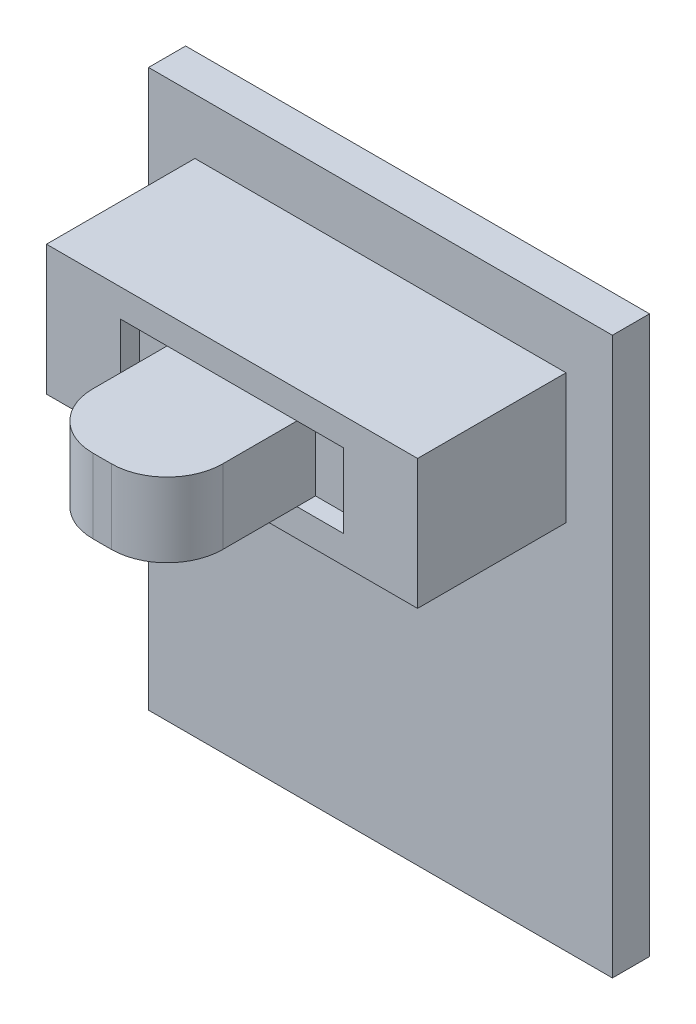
SolidWorks part; units mm, degrees
ref_plane "Plan de face" through (0, 0, 0) normal (0, 0, 1) x (1, 0, 0)
ref_plane "Plan de dessus" through (0, 0, 0) normal (0, 1, 0) x (1, 0, 0)
ref_plane "Plan de droite" through (0, 0, 0) normal (1, 0, 0) x (0, 0, -1)
sketch "Esquisse1" plane through (0, 0, 0) normal (0, 0, 1) x (1, 0, 0)
  line L1 (0, 0) -> (25, 0)
  line L2 (0, 0) -> (0, 30)
  line L3 (0, 30) -> (25, 30)
  line L4 (25, 0) -> (25, 30)
  dimension "D1" = 30
  dimension "D2" = 25
extrude "Extrusion1" add sketch "Esquisse1" along normal blind 2
sketch "Esquisse2" plane through (0, 0, 2) normal (0, 0, 1) x (1, 0, 0)
  line L0 (12.5, 30) -> (12.5, 0) construction
  line L1 (2.5, 27) -> (22.5, 27)
  line L2 (2.5, 27) -> (2.5, 20)
  line L3 (2.5, 20) -> (22.5, 20)
  line L4 (22.5, 27) -> (22.5, 20)
  line L5 (25, 30) -> (0, 30) construction
  line L6 (0, 0) -> (25, 0) construction
  line L7 (12.5, 20) -> (12.5, 50) construction
  dimension "D1" = 20
  dimension "D2" = 7
  dimension "D3" = 3
extrude "Extrusion2" add sketch "Esquisse2" along normal blind 8
sketch "Esquisse4" plane through (0, 0, 10) normal (0, 0, 1) x (1, 0, 0)
  line L0 (12.5, 27) -> (12.5, 17.3147) construction
  line L1 (6.5, 25.5) -> (18.5, 25.5)
  line L2 (6.5, 25.5) -> (6.5, 21.5)
  line L3 (6.5, 21.5) -> (18.5, 21.5)
  line L4 (18.5, 25.5) -> (18.5, 21.5)
  line L5 (22.5, 27) -> (2.5, 27) construction
  line L6 (12.5, 21.5) -> (12.5, 30) construction
  line L7 (25, 30) -> (0, 30) construction
  dimension "D1" = 12
  dimension "D2" = 4
  dimension "D3" = 1.5
extrude "Enlèv. mat.-Extru.1" cut sketch "Esquisse4" against normal blind 2
sketch "Esquisse5" plane through (0, 0, 8) normal (0, 0, 1) x (1, 0, 0)
  line L0 (6.5, 21.5) -> (18.5, 21.5) construction
  line L1 (6.5, 25.5) -> (18.5, 25.5)
  line L2 (6.5, 25.5) -> (6.5, 21.5)
  line L3 (6.5, 21.5) -> (18.5, 21.5)
  line L4 (18.5, 25.5) -> (18.5, 21.5)
  line L5 (18.5, 21.5) -> (18.5, 25.5) construction
extrude "Extrusion3" add sketch "Esquisse5" along normal blind 1
sketch "Esquisse6" plane through (0, 0, 9) normal (0, 0, 1) x (1, 0, 0)
  line L1 (9, 25.5) -> (9, 21.5)
  line L3 (6.5, 25.5) -> (6.5, 21.5) construction
  line L4 (6.5, 21.5) -> (18.5, 21.5) construction
  line L5 (18.5, 25.5) -> (6.5, 25.5) construction
  line L6 (9, 21.5) -> (16, 21.5)
  line L7 (16, 25.5) -> (9, 25.5)
  line L8 (12.5, 31.87) -> (12.5, 13.6564) construction
  line L9 (16, 25.5) -> (16, 21.5)
  dimension "D1" = 2.5
  dimension "D2" = 7
extrude "Extrusion4" add sketch "Esquisse6" along normal blind 8
fillet "Congé1" radius 3 2 edges at (9, 23.5, 17) (16, 23.5, 17)
